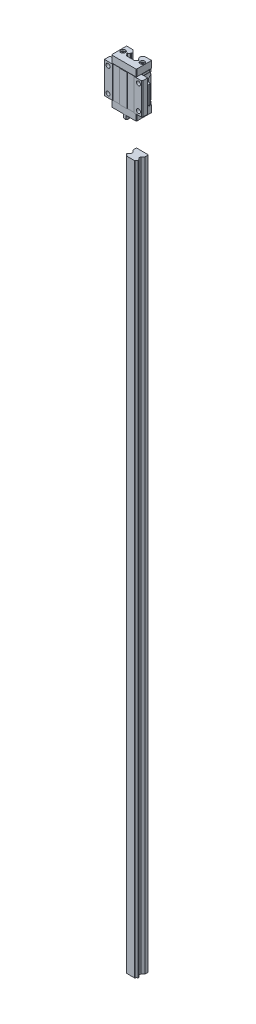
SolidWorks part; units mm, degrees
ref_plane "Front Plane" through (0, 0, 0) normal (0, 0, 1) x (1, 0, 0)
ref_plane "Top Plane" through (0, 0, 0) normal (0, 1, 0) x (1, 0, 0)
ref_plane "Right Plane" through (0, 0, 0) normal (1, 0, 0) x (0, 0, -1)
imported_body "Imported3"
sketch "Sketch1" plane through (0, 1.7999, 0) normal (0, 1, 0) x (-1, 0, 0)
  line L0 (-22.3768, -10.8396) -> (-23, -10.8396)
  line L1 (-23, -10.8396) -> (-23, -10.8812)
  arc A0 (-23, -10.8812) -> (-22.3768, -10.8396) centre (-22.3564, -15.8396) cw
extrude "Cut-Extrude1" cut sketch "Sketch1" against normal blind 6
sketch "Sketch2" plane through (0, -32.7001, 0) normal (0, -1, 0) x (1, 0, 0)
  line L0 (23, -10.8396) -> (22.3768, -10.8396)
  line L1 (23, -10.8812) -> (23, -10.8396)
  arc A0 (22.3768, -10.8396) -> (23, -10.8812) centre (22.3564, -15.8396) cw
extrude "Cut-Extrude2" cut sketch "Sketch2" against normal blind 6
sketch "Sketch3" plane through (0, -32.7001, 0) normal (0, -1, 0) x (1, 0, 0)
  line L0 (23, -7.3502) -> (23, -10.8396)
  line L1 (23, -10.8396) -> (16, -10.8396)
  line L2 (16, -10.8396) -> (16, -19.65)
  line L3 (16, -19.65) -> (-16, -19.65)
  line L4 (-16, -19.65) -> (-16, -6.8502)
  line L5 (-16, -6.8502) -> (23.5, -6.8502)
  line L6 (23.5, -6.8502) -> (23, -7.3502)
extrude "Boss-Extrude1" add sketch "Sketch3" along normal blind 2.4
ref_plane "Plane1" through (0, -26.7001, 0) normal (0, -1, 0) x (1, 0, 0)
sketch "Sketch4" plane through (0, -26.7001, 0) normal (0, -1, 0) x (1, 0, 0)
  line L0 (22.336, -10.8396) -> (22.3768, -10.8396)
  arc A0 (22.3768, -10.8396) -> (22.336, -10.8396) centre (22.3564, -15.8396) ccw
extrude "Cut-Extrude3" cut sketch "Sketch4" against normal blind 22.5
sketch "Sketch5" plane through (0, -35.1001, 0) normal (0, -1, 0) x (1, 0, 0)
  line L0 (23.5, -6.8502) -> (23, -6.8502)
  line L1 (23, -6.8502) -> (23, -7.3502)
  line L2 (23, -7.3502) -> (23.5, -6.8502)
extrude "Cut-Extrude4" cut sketch "Sketch5" against normal blind 8.4
sketch "Sketch6" plane through (0, 1.7999, 0) normal (0, 1, 0) x (-1, 0, 0)
  line L0 (-23.5, -6.8502) -> (-23, -7.3502)
  line L1 (-23, -7.3502) -> (-23, -6.8502)
  line L2 (-23, -6.8502) -> (-23.5, -6.8502)
extrude "Cut-Extrude5" cut sketch "Sketch6" against normal blind 6
sketch "Sketch7" plane through (23, 0, 0) normal (1, 0, 0) x (0, 0, -1)
  line L0 (6.8502, 1.7999) -> (10.8396, 1.7999)
  line L1 (10.8396, 1.7999) -> (10.8396, -4.2001)
  line L2 (10.8396, -4.2001) -> (6.8502, -4.2001)
  line L3 (6.8502, -4.2001) -> (6.8502, 1.7999)
extrude "Boss-Extrude2" add sketch "Sketch7" along normal blind 0.5
sketch "Sketch8" plane through (0, 0, -19.65) normal (0, 0, -1) x (-1, 0, 0)
  line L0 (19, -4.2001) -> (20.8437, -4.2001)
  line L1 (20.8437, -4.2001) -> (20.8437, 1.7999)
  line L2 (20.8437, 1.7999) -> (16, 1.7999)
  arc A0 (16, 1.7999) -> (19, -4.2001) centre (19, -0.4501) ccw
extrude "Cut-Extrude6" cut sketch "Sketch8" against normal blind 7.5181
sketch "Sketch9" plane through (0, 0, -12.1319) normal (0, 0, -1) x (-1, 0, 0)
  line L0 (19, -4.2001) -> (20.8437, -4.2001)
  line L1 (20.8437, -4.2001) -> (20.8437, 1.7999)
  line L2 (20.8437, 1.7999) -> (16, 1.7999)
  arc A0 (16, 1.7999) -> (19, -4.2001) centre (19, -0.4501) ccw
extrude "Cut-Extrude7" cut sketch "Sketch9" against normal blind 1.2817
sketch "Sketch10" plane through (23, 0, 0) normal (1, 0, 0) x (0, 0, -1)
  line L0 (6.8502, -26.7001) -> (10.8396, -26.7001)
  line L1 (10.8396, -26.7001) -> (10.8396, -35.1001)
  line L2 (10.8396, -35.1001) -> (6.8502, -35.1001)
  line L3 (6.8502, -35.1001) -> (6.8502, -26.7001)
extrude "Boss-Extrude3" add sketch "Sketch10" along normal blind 0.5
sketch "Sketch11" plane through (0, 0, -6.8502) normal (0, 0, 1) x (1, 0, 0)
  line L0 (-20.8437, -35.1001) -> (-20.8437, 1.7999)
  line L1 (-20.8437, 1.7999) -> (23.5, 1.7999)
  line L2 (23.5, 1.7999) -> (23.5, -35.1001)
  line L3 (23.5, -35.1001) -> (-20.8437, -35.1001)
extrude "Boss-Extrude4" add sketch "Sketch11" along normal blind 7
sketch "Sketch12" plane through (0, 0, -10.8396) normal (0, 0, -1) x (-1, 0, 0)
  line L0 (-16, 1.7999) -> (-23.5, 1.7999)
  line L1 (-23.5, 1.7999) -> (-23.5, -4.2001)
  line L2 (-23.5, -4.2001) -> (-23, -4.2001)
  line L3 (-23, -4.2001) -> (-19, -4.2001)
  arc A0 (-19, -4.2001) -> (-16, 1.7999) centre (-19, -0.4501) ccw
extrude "Cut-Extrude8" cut sketch "Sketch12" against normal blind 3.4894
sketch "Sketch13" plane through (0, 0, -10.8396) normal (0, 0, -1) x (-1, 0, 0)
  line L0 (-16, -35.1001) -> (-16, -32.7001)
  line L1 (-19, -26.7001) -> (-23, -26.7001)
  line L2 (-23, -26.7001) -> (-23.5, -26.7001)
  line L3 (-23.5, -26.7001) -> (-23.5, -35.1001)
  line L4 (-23.5, -35.1001) -> (-16, -35.1001)
  arc A0 (-16, -32.7001) -> (-19, -26.7001) centre (-19, -30.4501) ccw
extrude "Cut-Extrude9" cut sketch "Sketch13" against normal blind 3.4894
sketch "Sketch14" plane through (0, 0, -7.3502) normal (0, 0, -1) x (-1, 0, 0)
  line L0 (-16, -35.1001) -> (-16, -32.7001)
  line L1 (-19, -26.7001) -> (-23.5, -26.7001)
  line L2 (-23.5, -26.7001) -> (-23.5, -35.1001)
  line L3 (-23.5, -35.1001) -> (-16, -35.1001)
  arc A0 (-16, -32.7001) -> (-19, -26.7001) centre (-19, -30.4501) ccw
extrude "Cut-Extrude10" cut sketch "Sketch14" against normal blind 0.5
sketch "Sketch15" plane through (-20.8437, 0, 0) normal (-1, 0, 0) x (0, 0, 1)
  line L0 (-10.8502, 1.7999) -> (0.1498, 1.7999)
  line L1 (0.1498, 1.7999) -> (0.1498, -35.1001)
  line L2 (0.1498, -35.1001) -> (-6.8502, -35.1001)
  line L3 (-6.8502, -35.1001) -> (-6.8502, -26.7001)
  line L4 (-6.8502, -26.7001) -> (-10.8502, -26.7001)
  line L5 (-10.8502, -26.7001) -> (-10.8502, 1.7999)
extrude "Boss-Extrude5" add sketch "Sketch15" along normal blind 2.6563
sketch "Sketch16" plane through (0, 0, -7.3502) normal (0, 0, -1) x (-1, 0, 0)
  line L0 (-16, 1.7999) -> (-23.5, 1.7999)
  line L1 (-23.5, 1.7999) -> (-23.5, -4.2001)
  line L2 (-23.5, -4.2001) -> (-19, -4.2001)
  arc A0 (-19, -4.2001) -> (-16, 1.7999) centre (-19, -0.4501) ccw
extrude "Cut-Extrude11" cut sketch "Sketch16" against normal blind 0.5
sketch "Sketch17" plane through (0, 0, -10.8502) normal (0, 0, -1) x (-1, 0, 0)
  line L0 (23.5, -4.2001) -> (23.5, 1.7999)
  line L1 (23.5, 1.7999) -> (16, 1.7999)
  line L2 (19, -4.2001) -> (23.5, -4.2001)
  arc A0 (16, 1.7999) -> (19, -4.2001) centre (19, -0.4501) ccw
extrude "Cut-Extrude12" cut sketch "Sketch17" against normal blind 4
sketch "Sketch18" plane through (0, 1.7999, 0) normal (0, 1, 0) x (-1, 0, 0)
  line L0 (-23.5, 0.1498) -> (23.5, 0.1498)
  line L1 (23.5, 0.1498) -> (23.5, -6.8502)
  line L2 (23.5, -6.8502) -> (16, -6.8502)
  line L3 (16, -6.8502) -> (16, -19.65)
  line L4 (16, -19.65) -> (-16, -19.65)
  line L5 (-16, -19.65) -> (-16, -6.8502)
  line L6 (-16, -6.8502) -> (-23.5, -6.8502)
  line L7 (-23.5, -6.8502) -> (-23.5, 0.1498)
extrude "Boss-Extrude6" add sketch "Sketch18" along normal blind 2.4
sketch "Sketch19" plane through (0, -35.1001, 0) normal (0, -1, 0) x (1, 0, 0)
  line L0 (-16, -19.65) -> (-15.5939, -19.65)
  line L1 (-16, -16.8291) -> (-16, -19.65)
  arc A0 (-15.5939, -19.65) -> (-16, -16.8291) centre (-25.5939, -19.65) ccw
extrude "Cut-Extrude13" cut sketch "Sketch19" against normal up to next
sketch "Sketch20" plane through (0, -35.1001, 0) normal (0, -1, 0) x (1, 0, 0)
  line L0 (16, -19.65) -> (16, -16.8291)
  line L1 (15.5939, -19.65) -> (16, -19.65)
  arc A0 (16, -16.8291) -> (15.5939, -19.65) centre (25.5939, -19.65) ccw
extrude "Cut-Extrude14" cut sketch "Sketch20" against normal up to next
sketch "Sketch21" plane through (0, -35.1001, 0) normal (0, -1, 0) x (1, 0, 0)
  line L0 (15.6, -19.65) -> (-15.6, -19.65)
  line L1 (-15.6, -19.65) -> (-15.6, -0.65)
  line L2 (-15.6, -0.65) -> (15.6, -0.65)
  line L3 (15.6, -0.65) -> (15.6, -19.65)
extrude "Boss-Extrude7" add sketch "Sketch21" along normal blind 8.5
sketch "Sketch22" plane through (0, 4.1999, 0) normal (0, 1, 0) x (-1, 0, 0)
  line L0 (15.5939, -19.65) -> (16, -19.65)
  line L1 (16, -19.65) -> (16, -16.8291)
  arc A0 (16, -16.8291) -> (15.5939, -19.65) centre (25.5939, -19.65) ccw
extrude "Cut-Extrude15" cut sketch "Sketch22" against normal up to next
sketch "Sketch23" plane through (0, 4.1999, 0) normal (0, 1, 0) x (-1, 0, 0)
  line L0 (-16, -16.8291) -> (-16, -19.65)
  line L1 (-16, -19.65) -> (-15.5939, -19.65)
  arc A0 (-15.5939, -19.65) -> (-16, -16.8291) centre (-25.5939, -19.65) ccw
extrude "Cut-Extrude16" cut sketch "Sketch23" against normal up to next
sketch "Sketch24" plane through (0, 4.1999, 0) normal (0, 1, 0) x (-1, 0, 0)
  line L0 (15.6, -19.65) -> (-15.6, -19.65)
  line L1 (-15.6, -19.65) -> (-15.6, -0.65)
  line L2 (-15.6, -0.65) -> (15.6, -0.65)
  line L3 (15.6, -0.65) -> (15.6, -19.65)
extrude "Boss-Extrude8" add sketch "Sketch24" along normal blind 8.5
sketch "Sketch25" plane through (0, 4.1999, 0) normal (0, 1, 0) x (-1, 0, 0)
  line L0 (-4.5004, 0.1498) -> (-13.5005, 0.1498)
  line L1 (-13.5005, 0.1498) -> (-13.0005, -0.3502)
  line L2 (-13.0005, -0.3502) -> (-5.0004, -0.3502)
  line L3 (-5.0004, -0.3502) -> (-4.5004, 0.1498)
extrude "Cut-Extrude17" cut sketch "Sketch25" against normal through all
sketch "Sketch26" plane through (0, 4.1999, 0) normal (0, 1, 0) x (-1, 0, 0)
  line L0 (13.5, 0.1498) -> (4.5, 0.1498)
  line L1 (4.5, 0.1498) -> (4.9998, -0.35)
  line L2 (4.9998, -0.35) -> (13.0002, -0.35)
  line L3 (13.0002, -0.35) -> (13.5, 0.1498)
extrude "Cut-Extrude18" cut sketch "Sketch26" against normal through all
sketch "Sketch27" plane through (0, 12.6999, 0) normal (0, 1, 0) x (-1, 0, 0)
  line L0 (7.4011, -19.65) -> (4.73, -16.9789)
  line L1 (4.73, -16.9789) -> (4.73, -15.0209)
  line L2 (4.73, -15.0209) -> (5.4472, -14.3037)
  line L3 (7.43, -12.6044) -> (7.43, -10.8955)
  line L4 (5.4544, -8.9199) -> (-5.4544, -8.9199)
  line L5 (-7.43, -10.8955) -> (-7.43, -12.6044)
  line L6 (-5.4472, -14.3037) -> (-4.73, -15.0209)
  line L7 (-4.73, -15.0209) -> (-4.73, -16.9789)
  line L8 (-4.73, -16.9789) -> (-7.4011, -19.65)
  line L9 (-7.4011, -19.65) -> (7.4011, -19.65)
  arc A0 (5.4472, -14.3037) -> (7.43, -12.6044) centre (7.2449, -14.3948) cw
  arc A1 (7.43, -10.8955) -> (5.4544, -8.9199) centre (7.2449, -9.105) cw
  arc A2 (-5.4544, -8.9199) -> (-7.43, -10.8955) centre (-7.2449, -9.105) cw
  arc A3 (-7.43, -12.6044) -> (-5.4472, -14.3037) centre (-7.2449, -14.3948) cw
extrude "Cut-Extrude19" cut sketch "Sketch27" against normal through all
hole_wizard "CBORE for M2.5 Hex Head Machine Screw1" positions "Sketch29" profile "Sketch28" counterbore size "M2.5" standard "Ansi Metric"
sketch "Sketch29" plane through (0, 12.6999, 0) normal (0, 1, 0) x (-1, 0, 0)
  point P0 (-12.1, -11.7499)
  point P1 (12.1, -11.7499)
sketch "Sketch28" plane through (12.1, 12.6999, -11.7499) normal (1, 0, 0) x (0, 0, 1)
  line L0 (0, 0) -> (0, 6)
  line L1 (0, 6) -> (1.5, 6)
  line L2 (1.5, 6) -> (1.5, 2)
  line L3 (1.5, 2) -> (2.9, 2)
  line L4 (2.9, 2) -> (2.9, 0)
  line L5 (2.9, 0) -> (0, 0)
  line L10 (0, 6) -> (-1.5, 6) construction
  line L11 (0, -6.35) -> (0, 107.95) construction
  dimension "Hole Dia." = 3
  dimension "Hole Depth" = 6
  dimension "C'Bore Dia." = 5.8
  dimension "C'Bore Depth" = 2
  dimension "Drill Angle" = 180
hole_wizard "CBORE for M2.5 Hex Head Machine Screw2" positions "Sketch31" profile "Sketch30" counterbore size "M2.5" standard "Ansi Metric"
sketch "Sketch31" plane through (0, -43.6001, 0) normal (0, -1, 0) x (1, 0, 0)
  point P0 (12.1, -11.7499)
  point P1 (-12.1, -11.7499)
sketch "Sketch30" plane through (12.1, -43.6001, -11.7499) normal (1, 0, 0) x (0, 0, -1)
  line L0 (0, 0) -> (0, 6)
  line L1 (0, 6) -> (1.5, 6)
  line L2 (1.5, 6) -> (1.5, 2)
  line L3 (1.5, 2) -> (2.9, 2)
  line L4 (2.9, 2) -> (2.9, 0)
  line L5 (2.9, 0) -> (0, 0)
  line L10 (0, 6) -> (-1.5, 6) construction
  line L11 (0, -6.35) -> (0, 107.95) construction
  dimension "Hole Dia." = 3
  dimension "Hole Depth" = 6
  dimension "C'Bore Dia." = 5.8
  dimension "C'Bore Depth" = 2
  dimension "Drill Angle" = 180
hole_wizard "Ø5.0 (5) Diameter Hole1" positions "Sketch33" profile "Sketch32" hole size "Ø5.0" standard "Ansi Metric"
sketch "Sketch33" plane through (0, 0, -6.8502) normal (0, 0, -1) x (-1, 0, 0)
  point P0 (-19, -30.4501)
  point P1 (19, -0.4501)
sketch "Sketch32" plane through (19, -30.4501, -6.8502) normal (1, 0, 0) x (0, 1, 0)
  line L0 (0, 0) -> (0, 7)
  line L1 (0, 7) -> (2.5, 7)
  line L2 (2.5, 7) -> (2.5, 0)
  line L5 (2.5, 0) -> (0, 0)
  line L11 (0, -6.35) -> (0, 107.95) construction
  dimension "Thru Hole Dia." = 5
  dimension "Thru Hole Depth" = 7
hole_wizard "Ø5.0 (5) Diameter Hole2" positions "Sketch35" profile "Sketch34" hole size "Ø5.0" standard "Ansi Metric"
sketch "Sketch35" plane through (0, 0, 0.1498) normal (0, 0, 1) x (1, 0, 0)
  point P0 (19, -0.4501)
  point P1 (-19, -30.4501)
sketch "Sketch34" plane through (19, -0.4501, 0.1498) normal (1, 0, 0) x (0, -1, 0)
  line L0 (0, 0) -> (0, 19.7999)
  line L1 (0, 19.7999) -> (2.5, 19.7999)
  line L2 (2.5, 19.7999) -> (2.5, 0)
  line L5 (2.5, 0) -> (0, 0)
  line L11 (0, -6.35) -> (0, 107.95) construction
  dimension "Thru Hole Dia." = 5
  dimension "Thru Hole Depth" = 19.7999
chamfer "Chamfer2" distance 0.2622 angle 45 4 edges at (-5.4544, -15.4501, -8.9199) (-7.43, -15.4501, -12.6044) (7.43, -15.4501, -10.8955) (7.43, -15.4501, -12.6044)
chamfer "Chamfer3" distance 0.8496 angle 45 8 edges at (15.25, -30.4501, -19.65) (15.7712, -32.3573, -17.775) (15.5939, -15.4501, -19.65) (15.25, -0.4501, -19.65)
chamfer "Chamfer4" distance 0.9997 angle 45 1 edges at (23.5, -15.4501, 0.1498)
chamfer "Chamfer5" distance 0.5 angle 45 4 edges at (15.6, 8.4499, -0.65) (-15.6, 8.4499, -0.65) (15.6, -39.3501, -0.65) (-15.6, -39.3501, -0.65)
chamfer "Chamfer6" distance 0.2622 angle 45 2 edges at (-7.43, -15.4501, -10.8955) (5.4544, -15.4501, -8.9199)
chamfer "Chamfer7" distance 0.8496 angle 45 5 edges at (-15.25, -0.4501, -19.65) (-15.5939, -15.4501, -19.65) (-15.25, -30.4501, -19.65)
fillet "Fillet1" radius 0.5 2 edges at (23, -15.4501, -7.3502)
fillet "Fillet2" radius 1 2 edges at (23, -15.4501, -10.8812) (-23.5, -15.4501, -10.8502)
fillet "Fillet3" radius 5 1 edges at (-20.8437, -15.4501, -10.8502)
imported_body "Imported5"
sketch "Sketch36" plane through (0, -95.4501, 0) normal (0, -1, 0) x (1, 0, 0)
  line L20 (5.4472, -9.1961) -> (5.171, -8.9199)
  line L21 (5.171, -8.9199) -> (-5.171, -8.9199)
  line L22 (-5.171, -8.9199) -> (-5.4472, -9.1961)
  line L23 (-7.1538, -10.9027) -> (-7.43, -11.1789)
  line L24 (-7.43, -11.1789) -> (-7.43, -12.3209)
  line L25 (-7.43, -12.3209) -> (-7.1538, -12.5971)
  line L26 (-5.4472, -14.3037) -> (-4.73, -15.0209)
  line L27 (-4.73, -15.0209) -> (-4.73, -16.9789)
  line L28 (-4.73, -16.9789) -> (-7.5, -19.7489)
  line L29 (-7.5, -19.7489) -> (-7.5, -23.1499)
  line L30 (-7.5, -23.1499) -> (-6.8, -23.8499)
  line L31 (-6.8, -23.8499) -> (6.8, -23.8499)
  line L32 (6.8, -23.8499) -> (7.5, -23.1499)
  line L33 (7.5, -23.1499) -> (7.5, -19.7489)
  line L34 (7.5, -19.7489) -> (4.73, -16.9789)
  line L35 (4.73, -16.9789) -> (4.73, -15.0209)
  line L36 (4.73, -15.0209) -> (5.4472, -14.3037)
  line L37 (7.1538, -12.5971) -> (7.43, -12.3209)
  line L38 (7.43, -12.3209) -> (7.43, -11.1789)
  line L39 (7.43, -11.1789) -> (7.1538, -10.9027)
  line L40 (5.4472, -9.1961) -> (5.171, -8.9199)
  line L41 (5.171, -8.9199) -> (-5.171, -8.9199)
  line L42 (-5.171, -8.9199) -> (-5.4472, -9.1961)
  line L43 (-7.1538, -10.9027) -> (-7.43, -11.1789)
  line L44 (-7.43, -11.1789) -> (-7.43, -12.3209)
  line L45 (-7.43, -12.3209) -> (-7.1538, -12.5971)
  line L46 (-5.4472, -14.3037) -> (-4.73, -15.0209)
  line L47 (-4.73, -15.0209) -> (-4.73, -16.9789)
  line L48 (-4.73, -16.9789) -> (-7.5, -19.7489)
  line L49 (-7.5, -19.7489) -> (-7.5, -23.1499)
  line L50 (-7.5, -23.1499) -> (-6.8, -23.8499)
  line L51 (-6.8, -23.8499) -> (6.8, -23.8499)
  line L52 (6.8, -23.8499) -> (7.5, -23.1499)
  line L53 (7.5, -23.1499) -> (7.5, -19.7489)
  line L54 (7.5, -19.7489) -> (4.73, -16.9789)
  line L55 (4.73, -16.9789) -> (4.73, -15.0209)
  line L56 (4.73, -15.0209) -> (5.4472, -14.3037)
  line L57 (7.1538, -12.5971) -> (7.43, -12.3209)
  line L58 (7.43, -12.3209) -> (7.43, -11.1789)
  line L59 (7.43, -11.1789) -> (7.1538, -10.9027)
  arc A4 (-7.1538, -10.9027) -> (-5.4472, -9.1961) centre (-7.2449, -9.105) ccw
  arc A5 (-5.4472, -14.3037) -> (-7.1538, -12.5971) centre (-7.2449, -14.3948) ccw
  arc A6 (7.1538, -12.5971) -> (5.4472, -14.3037) centre (7.2449, -14.3948) ccw
  arc A7 (5.4472, -9.1961) -> (7.1538, -10.9027) centre (7.2449, -9.105) ccw
  arc A8 (-7.1538, -10.9027) -> (-5.4472, -9.1961) centre (-7.2449, -9.105) ccw
  arc A9 (-5.4472, -14.3037) -> (-7.1538, -12.5971) centre (-7.2449, -14.3948) ccw
  arc A10 (7.1538, -12.5971) -> (5.4472, -14.3037) centre (7.2449, -14.3948) ccw
  arc A11 (5.4472, -9.1961) -> (7.1538, -10.9027) centre (7.2449, -9.105) ccw
  dimension "D1" = 0
extrude "Boss-Extrude9" add sketch "Sketch36" along normal blind 883 separate body
